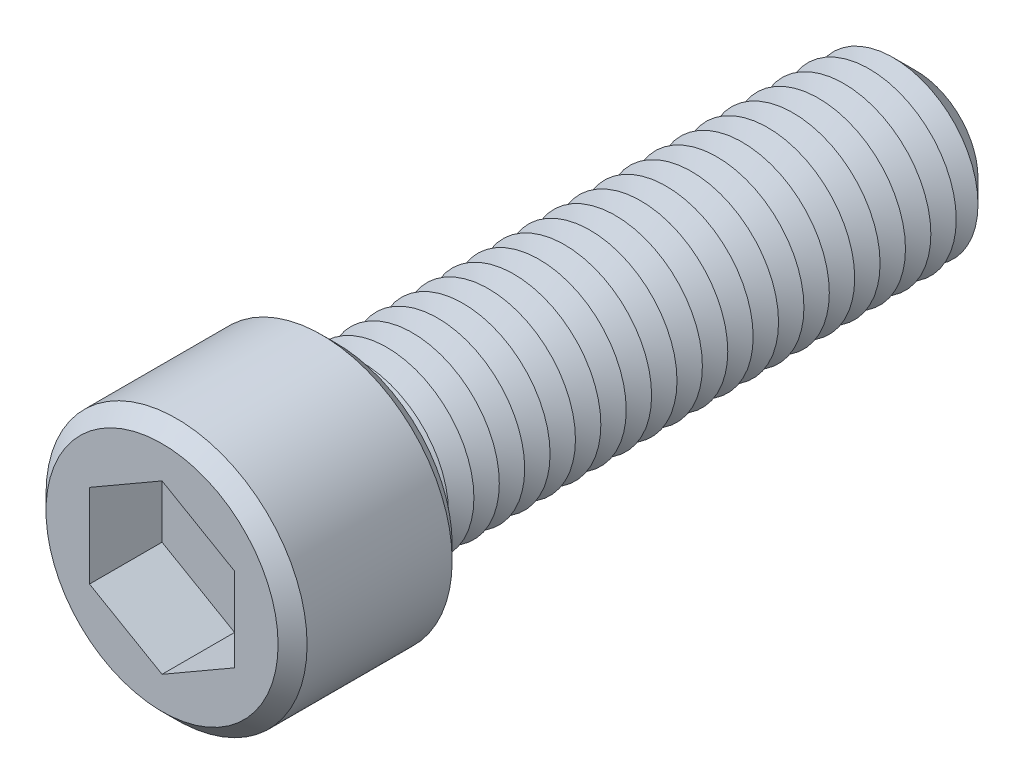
SolidWorks part; units mm, degrees
ref_plane "Front Plane" through (0, 0, 0) normal (0, 0, 1) x (1, 0, 0)
ref_plane "Top Plane" through (0, 0, 0) normal (0, 1, 0) x (1, 0, 0)
ref_plane "Right Plane" through (0, 0, 0) normal (1, 0, 0) x (0, 0, -1)
sketch "Sketch1" plane through (0, 0, 0) normal (0, 0, 1) x (1, 0, 0)
  circle A0 centre (0, 0) radius 9
  dimension "D1" = 18
extrude "Boss-Extrude1" add sketch "Sketch1" along normal blind 12
sketch "Sketch2" plane through (0, 0, 0) normal (0, 0, -1) x (-1, 0, 0)
  circle A0 centre (0, 0) radius 6
  dimension "D1" = 12
extrude "Boss-Extrude2" add sketch "Sketch2" along normal blind 40
chamfer "Chamfer1" distance 1.75 angle 45 1 edges at (-6, 0, -40)
sketch "Sketch3" plane through (0, 0, 0) normal (1, 0, 0) x (0, 0, -1)
  line L0 (-2.5121, 0) -> (4.5776, 0) construction
sketch "Sketch4" plane through (0, 0, 0) normal (1, 0, 0) x (0, 0, -1)
  line L0 (0, 6) -> (0.875, 4.4845)
  line L1 (0.875, 4.4845) -> (1.75, 6)
  line L2 (38.25, 6) -> (0, 6) construction
  line L3 (1.75, 6) -> (0, 6)
  dimension "D1" = 1.75
revolve "Cut-Revolve1" cut sketch "Sketch4" angle 360 about L0
pattern_linear "LPattern1" count 22 spacing 1.75 along (0, 0, -1) of "Cut-Revolve1"
sketch "Sketch5" plane through (0, 0, 12) normal (0, 0, 1) x (1, 0, 0)
  line L1 (0, 5.7735) -> (-5, 2.8868)
  line L2 (-5, 2.8868) -> (-5, -2.8868)
  line L3 (-5, -2.8868) -> (0, -5.7735)
  line L4 (0, -5.7735) -> (5, -2.8868)
  line L5 (5, -2.8868) -> (5, 2.8868)
  line L6 (5, 2.8868) -> (0, 5.7735)
  circle A0 centre (0, 0) radius 5 construction
  dimension "D1" = 10
extrude "Cut-Extrude1" cut sketch "Sketch5" against normal blind 5
sketch "Sketch6" plane through (0, 0, 7) normal (0, 0, 1) x (1, 0, 0)
  circle A0 centre (0, 0) radius 0.9
  dimension "D1" = 1.8
extrude "Cut-Extrude2" cut sketch "Sketch6" against normal up to surface (47 mm away)
chamfer "Chamfer2" distance 1 angle 45 2 edges at (9, 0, 0) (9, 0, 12)
